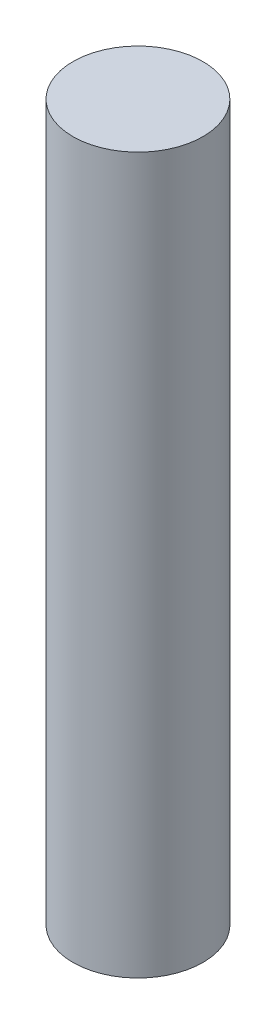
SolidWorks part; units mm, degrees
other "DetailItem3"
other "DetailItem4"
other "DetailItem5"
other "DetailItem6"
other "DetailItem7"
other "DetailItem8"
other "DetailItem9"
other "DetailItem10"
other "DetailItem11"
ref_plane "Front Plane" through (0, 0, 0) normal (0, 0, 1) x (1, 0, 0)
ref_plane "Top Plane" through (0, 0, 0) normal (0, 1, 0) x (1, 0, 0)
ref_plane "Right Plane" through (0, 0, 0) normal (1, 0, 0) x (0, 0, -1)
sketch "Sketch4" plane through (0, 0, 0) normal (1, 0, 0) x (0, 0, -1)
  line L0 (0, 0) -> (0, 3)
  line L1 (0, 3) -> (0, 4.5)
  line L2 (0, 4.5) -> (0, 6)
  line L3 (0, 6) -> (0, 7.5)
  line L4 (0, 7.5) -> (0, 9)
  line L5 (0, 9) -> (0, 10.5)
  line L6 (0, 10.5) -> (0, 12)
  line L7 (0, 12) -> (0, 13.5)
  line L8 (0, 13.5) -> (0, 16.5)
  line L9 (0, 16.5) -> (0, 19.5)
  line L10 (0, 19.5) -> (0, 21)
  line L11 (-1.5, 13.5) -> (1.5, 13.5)
  line L12 (-1.5, 19.5) -> (1.5, 19.5)
  line L13 (0, 21) -> (0, 22.5)
  line L14 (0, 22.5) -> (0, 24)
  line L15 (0, 24) -> (0, 27)
  line L16 (0, 0) -> (0, -3)
  line L17 (0, -3) -> (0, -4.5)
  line L18 (0, -4.5) -> (0, -6)
  line L19 (-1.5, -3) -> (1.5, -3)
  line L20 (-1.5, 3) -> (1.5, 3)
  dimension "D1" = 3
  dimension "D2" = 1.5
  dimension "D3" = 3
  dimension "D4" = 3
  dimension "D5" = 1.5
  dimension "D6" = 3
  dimension "D7" = 3
  dimension "D8" = 1.5
sketch "Sketch3" plane through (0, 0, 0) normal (0, 1, 0) x (1, 0, 0)
  circle A0 centre (1.5, 0) radius 1.5
  dimension "D1" = 3
extrude "Boss-Extrude2" add sketch "Sketch3" along normal up to vertex (16.5 mm away) contours A0
sketch "Sketch6" plane through (0, 0, 0) normal (1, 0, 0) x (0, 0, -1)
  line L1 (0, 9) -> (0, 10.5) construction
  line L2 (0.5, 7.5) -> (-0.5, 7.5)
  line L3 (0.5, 7.5) -> (0.5, 10.5)
  line L4 (0.5, 10.5) -> (-0.5, 10.5)
  line L5 (-0.5, 7.5) -> (-0.5, 10.5)
  line L6 (0.5, 7.5) -> (-0.5, 10.5) construction
  line L7 (0.5, 10.5) -> (-0.5, 7.5) construction
  point P0 (0, 9)
  dimension "D1" = 1
extrude "Cut-Extrude2" cut sketch "Sketch6" along normal blind 1
sketch "Sketch7" plane through (0, 0, 0) normal (1, 0, 0) x (0, 0, -1)
  line L0 (0, 7.5) -> (0, 9) construction
  line L1 (0.5, 7.5) -> (-0.5, 7.5)
  line L2 (0.5, 7.5) -> (0.5, 9)
  line L3 (0.5, 9) -> (-0.5, 9)
  line L4 (-0.5, 7.5) -> (-0.5, 9)
  line L5 (0.5, 7.5) -> (-0.5, 9) construction
  line L6 (0.5, 9) -> (-0.5, 7.5) construction
  point P0 (0, 8.25)
  dimension "D1" = 1
extrude "Cut-Extrude3" cut sketch "Sketch7" along normal blind 1.5
